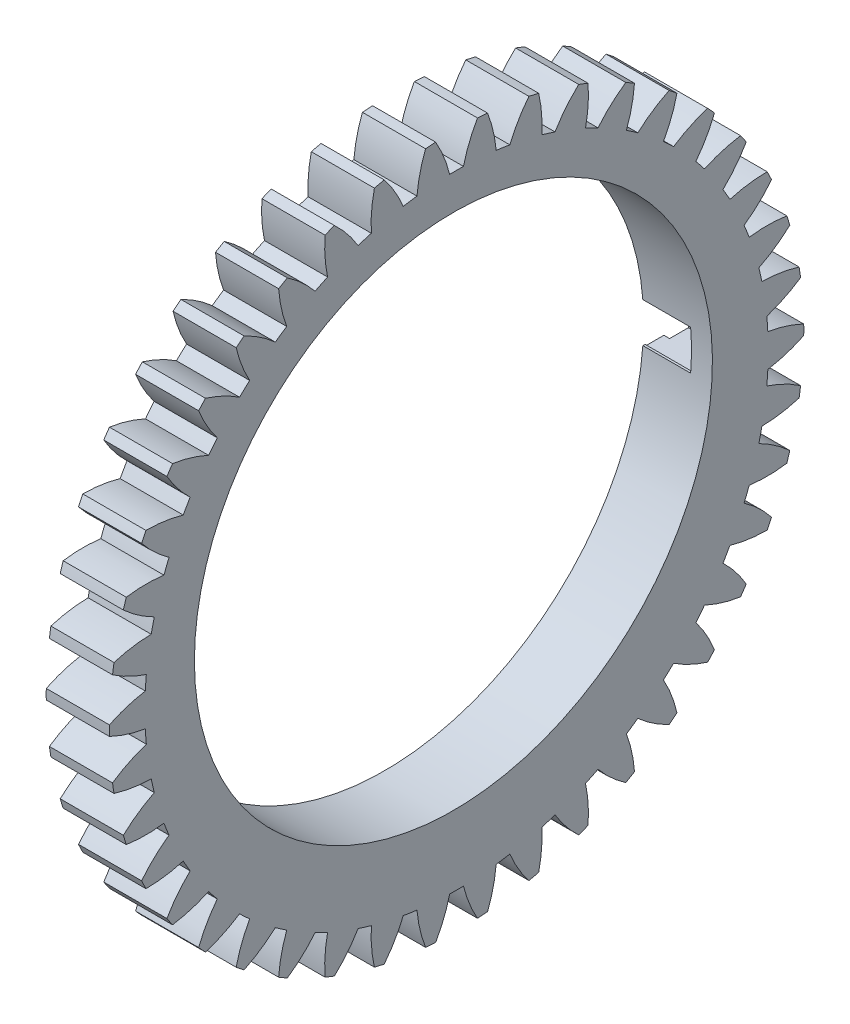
SolidWorks part; units mm, degrees
other "<spur gear_am>-<Bore>"
ref_plane "Front Plane" through (0, 0, 0) normal (0, 0, 1) x (1, 0, 0)
ref_plane "Top Plane" through (0, 0, 0) normal (0, 1, 0) x (1, 0, 0)
ref_plane "Right Plane" through (0, 0, 0) normal (1, 0, 0) x (0, 0, -1)
ref_plane "Plane1-spur gear_am" through (0, 0, 0) normal (0, 0, 1) x (1, 0, 0)
ref_plane "Plane2-spur gear_am" through (0, 0, 0) normal (0, 1, 0) x (1, 0, 0)
ref_plane "Plane3-spur gear_am" through (0, 0, 0) normal (1, 0, 0) x (0, 0, -1)
sketch "HoldingSke-spur gear_am" plane through (0, 0, 0) normal (0, 1, 0) x (1, 0, 0)
  line L0 (0, 0) -> (0.3716, -0.3346)
  line L1 (-15, 0) -> (100, 0) construction
  line L2 (0, 0) -> (-2.1039, 2.3779)
  line L3 (0, 0) -> (-11.863, 4.5341)
  line L4 (0, 0) -> (6.4178, 5.7786)
  line L5 (0, 0) -> (-9.3695, -3.4946)
  line L6 (0, 0) -> (-6.6317, -4.4744)
  line L7 (-2.1039, 2.3779) -> (0.0486, 12.1435)
  line L8 (-76.2, 54.61) -> (-72.4, 54.61)
  line L9 (-71.009, 38.7566) -> (-53.1078, 45.2721)
  line L10 (-76.2, 71.12) -> (104.1128, 71.12)
  line L11 (0, 0) -> (-8, 0)
  line L12 (-76.2, 101.6) -> (-76.133, 101.6)
  line L13 (24.9733, 27.94) -> (52.9518, 28.4284)
  line L14 (24.9733, 27.94) -> (24.9743, 27.94)
  line L15 (24.9733, 27.94) -> (100.4006, 29.5858)
  line L16 (-63.627, -2) -> (-12.827, -2)
  circle A0 centre (0, 0) radius 22.5
  circle A1 centre (0, 0) radius 35
  circle A2 centre (0, 0) radius 35
  circle A3 centre (0, 0) radius 22.5
  dimension "MHD" = 70
  dimension "Hub_dia" = 70
  dimension "Bore" = 45
  dimension "MBD" = 45
  dimension "Num_teeth" = 42
  dimension "Pitch_radius" = 180.3128
  dimension "Pitch" = 0.5
  dimension "Width" = 8
  dimension "Overall_len" = 10
  dimension "Show_teeth" = 42
  dimension "Thickness" = 8
  dimension "OAL" = 10.0001
  dimension "T_dim" = 3.8
  dimension "Ap" = 20
  dimension "H" = 19.05
  dimension "Backlash" = 0.067
  dimension "Addendum_fac" = 1
  dimension "Dedendum_fac" = 1.25
  dimension "Clearance_fac" = 0.25
  dimension "Dedendum_add" = 0.001
  dimension "Module" = 2
sketch "BasProSke-spur gear_am" plane through (0, 0, 0) normal (0, 1, 0) x (1, 0, 0)
  line L0 (-10, 0) -> (60, 0) construction
  line L1 (0, 0) -> (0, 44)
  line L2 (0, 0) -> (8, 0)
  line L3 (8, 0) -> (8, 44)
  line L4 (8, 44) -> (0, 44)
  dimension "Diameter" = 88
  dimension "Thickness" = 8
sketch "TooCutSke-spur gear_am" plane through (0, 0, 0) normal (1, 0, 0) x (0, 0, -1)
  line L1 (0, 0) -> (0, 107) construction
  line L2 (0, 0) -> (-1.6877, 41.9661) construction
  line L3 (0, 0) -> (-6.2736, 83.715) construction
  line L4 (-1.6877, 41.9661) -> (-3.1368, 41.8575) construction
  arc A0 (0.8776, 39.4892) -> (-0.8776, 39.4892) centre (0, 0) ccw
  arc A1 (2.6666, 43.9446) -> (-2.6666, 43.9446) centre (0, 0) ccw
  circle A2 centre (0, 0) radius 42 construction
  circle A3 centre (0, 0) radius 39.4671 construction
  arc A4 (-0.8776, 39.4892) -> (-2.6666, 43.9446) centre (-17.2022, 35.5209) ccw
  arc A5 (2.6666, 43.9446) -> (0.8776, 39.4892) centre (17.2022, 35.5209) ccw
  dimension "Root_dia" = 78.998
  dimension "Overcut_dia" = 88.0508
  dimension "Pitch_dia" = 84
  dimension "Base_dia" = 78.9342
  dimension "Flank_rad" = 16.8
  dimension "Half_ang" = 4.286
  dimension "Half_CT" = 1.4532
sketch "HubNeaOneSke-spur gear_am" plane through (0, 0, 0) normal (-1, 0, 0) x (0, 0, 1)
  circle A0 centre (0, 0) radius 35
  dimension "Diameter" = 70
sketch "HubNeaBotSke-spur gear_am" plane through (0, 0, 0) normal (-1, 0, 0) x (0, 0, 1)
  circle A0 centre (0, 0) radius 35
  dimension "Diameter" = 70
ref_plane "FarPln-spur gear_am" through (8, 0, 0) normal (1, 0, 0) x (0, 0, -1)
sketch "HubFarSke-spur gear_am" plane through (8, 0, 0) normal (1, 0, 0) x (0, 0, -1)
  circle A0 centre (0, 0) radius 35
  dimension "Diameter" = 70
sketch "BorSke-spur gear_am" plane through (0, 0, 0) normal (1, 0, 0) x (0, 0, -1)
  circle A0 centre (0, 0) radius 22.5
  dimension "Diameter" = 45
sketch "KeySke-spur gear_am" plane through (0, 0, 0) normal (1, 0, 0) x (0, 0, -1)
  line L0 (-7, 0) -> (-7, 26.3)
  line L1 (-7, 26.3) -> (7, 26.3)
  line L2 (7, 26.3) -> (7, 0)
  line L3 (0, 0) -> (0, 34) construction
  line L4 (-7, 0) -> (7, 0)
  dimension "Offset" = 26.3
  dimension "Width" = 14
inserted part "spur gear_am"
other "Cavity1"
other "Part6^Shooter1<1>@Shooter11"
sketch "Sketch9" plane through (-1, 0, 0) normal (-1, 0, 0) x (0, 0, 1)
  line L0 (-37.3789, -0.2624) -> (-37.3789, -0.4624)
  line L2 (-37.3789, -0.4624) -> (-32.6064, -0.4624)
  line L3 (-32.6064, -0.4624) -> (-32.6064, 4.9876)
  line L4 (-32.6064, 4.9876) -> (-37.7758, 4.9876)
  line L5 (-37.7758, 4.9876) -> (-37.3789, -0.2624)
  line L7 (-34.671, 4.7876) -> (-37.3789, 4.7876) construction
  line L9 (32, -0.4624) -> (32, 4.9876)
  line L10 (32, 4.9876) -> (38.1766, 4.9876)
  line L11 (38.1766, 4.9876) -> (38.1766, -0.4624)
  line L12 (38.1766, -0.4624) -> (32, -0.4624)
  line L13 (34.999, -0.2624) -> (38.1766, -0.2624) construction
  line L14 (38.1766, 4.7876) -> (34.671, 4.7876) construction
  line L15 (38.1766, -0.2624) -> (38.1766, 4.7876) construction
  dimension "D1" = 0.2
  dimension "D2" = 0.2
  dimension "D3" = 0.2
  dimension "D4" = 0.2
extrude "Cut-Extrude1" cut sketch "Sketch9" against normal up to vertex
